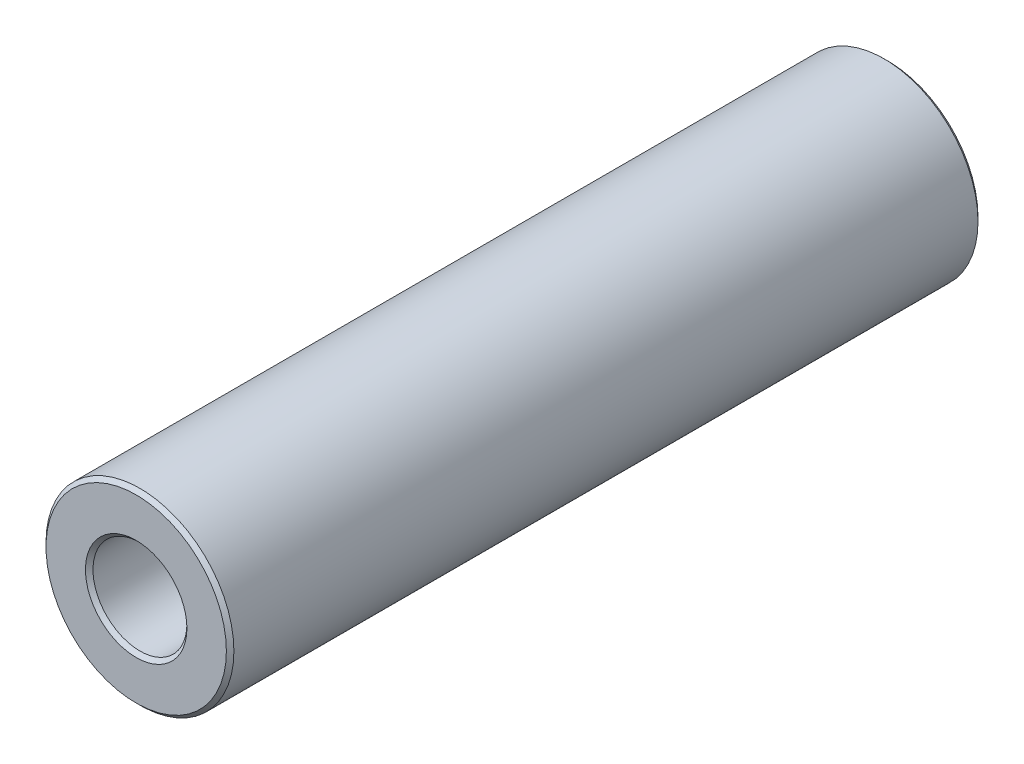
SolidWorks part; units mm, degrees
ref_plane "Front Plane" through (0, 0, 0) normal (0, 0, 1) x (1, 0, 0)
ref_plane "Top Plane" through (0, 0, 0) normal (0, 1, 0) x (1, 0, 0)
ref_plane "Right Plane" through (0, 0, 0) normal (1, 0, 0) x (0, 0, -1)
sketch "Sketch1" plane through (0, 0, 0) normal (0, 0, 1) x (1, 0, 0)
  circle A0 centre (0, 0) radius 2.5
  circle A1 centre (0, 0) radius 1.25
  dimension "D1" = 5
  dimension "D2" = 2.5
extrude "Boss-Extrude2" add sketch "Sketch1" along normal mid plane 20
chamfer "Chamfer3" distance 0.1 angle 45 4 edges at (2.5, 0, 10) (2.5, 0, -10) (1.25, 0, -10) (1.25, 0, 10)
